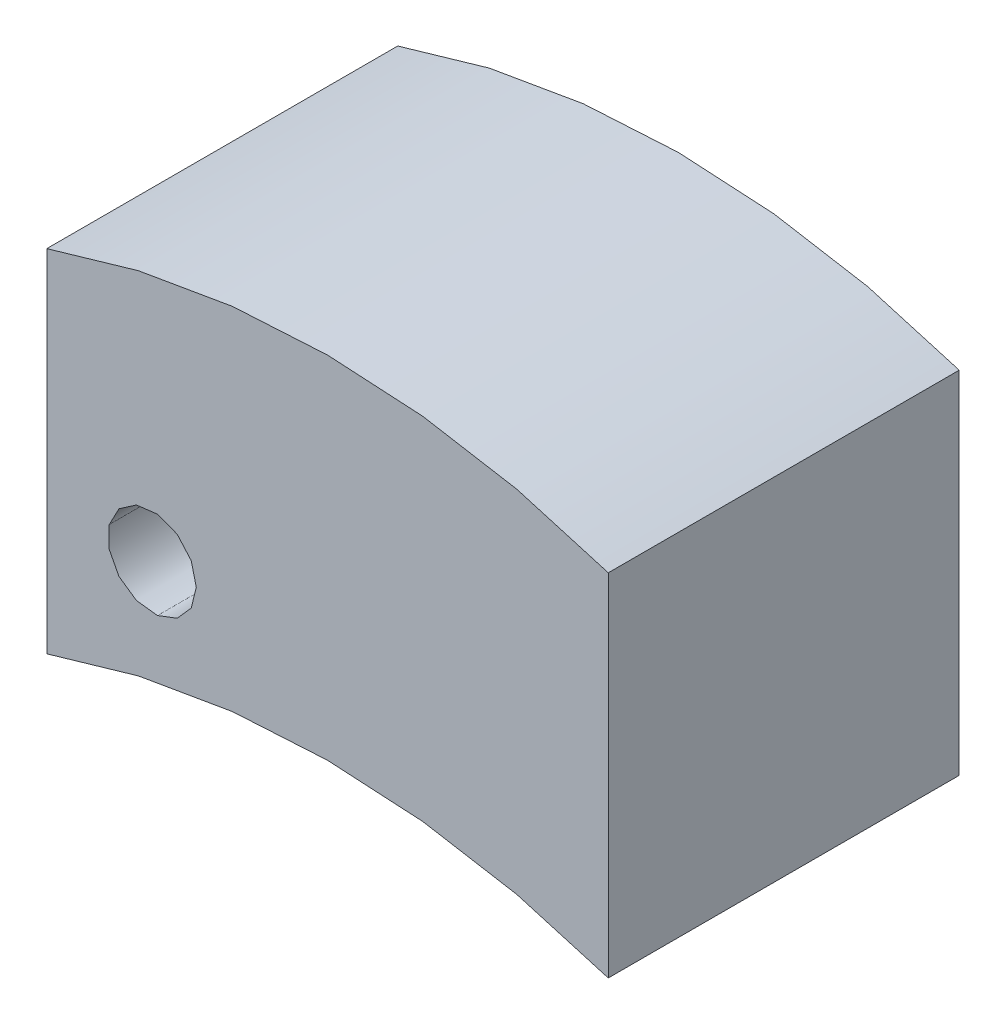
SolidWorks part; units mm, degrees
ref_plane "Front Plane" through (0, 0, 0) normal (0, 0, 1) x (1, 0, 0)
ref_plane "Top Plane" through (0, 0, 0) normal (0, 1, 0) x (1, 0, 0)
ref_plane "Right Plane" through (0, 0, 0) normal (1, 0, 0) x (0, 0, -1)
sketch "Sketch1" plane through (0, 0, 0) normal (0, 0, 1) x (1, 0, 0)
  line L2 (0, 0) -> (0, 31.75)
  line L4 (50.8, 0) -> (50.8, 31.75)
  arc A0 (50.8, 0) -> (0, 0) centre (25.4, -71.842) ccw
  arc A1 (50.8, 31.75) -> (0, 31.75) centre (25.4, -40.092) ccw
  dimension "D1" = 50.8
  dimension "D2" = 31.75
extrude "Extrude1" add sketch "Sketch1" along normal blind 31.75
sketch "Sketch4" plane through (0, 0, 31.75) normal (0, 0, 1) x (1, 0, 0)
  line L0 (0, 31.75) -> (0, 0) construction
  circle A0 centre (9.525, 11.978) radius 4
  arc A1 (50.8, 0) -> (0, 0) centre (25.4, -71.842) ccw construction
  dimension "D1" = 83.82
  dimension "D3" = 8
  dimension "D2" = 9.525
extrude "Extrude3" cut sketch "Sketch4" against normal blind 25.4
sketch "Sketch5" plane through (0, 0, 0) normal (0, 0, -1) x (-1, 0, 0)
  circle A0 centre (-25.4, 11.978) radius 2.3813
  arc A1 (0, 0) -> (-50.8, 0) centre (-25.4, -71.842) ccw construction
  point P2 (-25.4, 4.358)
  dimension "D1" = 7.62
extrude "Extrude4" cut sketch "Sketch5" against normal blind 16.51
sketch "Sketch6" plane through (0, 0, 0) normal (0, 0, -1) x (-1, 0, 0)
  circle A0 centre (-25.4, 11.978) radius 2.3813
extrude "Extrude5" add sketch "Sketch6" against normal blind 3.175
sketch "Sketch8" plane through (0, 0, 0) normal (0, 0, -1) x (-1, 0, 0)
  circle A0 centre (-25.4, 11.978) radius 0.3969
extrude "Extrude6" cut sketch "Sketch8" against normal blind 19.05
sketch "Sketch9" plane through (0, 0, 6.35) normal (0, 0, 1) x (1, 0, 0)
  circle A0 centre (9.525, 11.978) radius 0.3969
extrude "Extrude7" cut sketch "Sketch9" against normal blind 3.175
sketch "Sketch10" plane through (0, 0, 0) normal (-1, 0, 0) x (0, 0, 1)
  line L0 (3.175, 11.5811) -> (3.175, 12.3748) construction
  line L1 (6.35, 12.3748) -> (3.175, 12.3748) construction
  circle A0 centre (3.5719, 11.978) radius 0.3969
  dimension "D1" = 0.7937
  dimension "D2" = 0.3969
  dimension "D3" = 0.3969
extrude "Extrude8" cut sketch "Sketch10" against normal blind 19.05
sketch "Sketch11" plane through (0, 0, 0) normal (-1, 0, 0) x (0, 0, 1)
  circle A0 centre (3.5719, 11.978) radius 0.3969
extrude "Extrude11" add sketch "Sketch11" against normal blind 9.1281
sketch "Sketch12" plane through (50.8, 0, 0) normal (1, 0, 0) x (0, 0, -1)
  line L0 (-16.51, 12.3748) -> (-19.05, 12.3748) construction
  line L1 (-19.05, 11.5811) -> (-19.05, 12.3748) construction
  circle A0 centre (-18.6531, 11.978) radius 0.3969
extrude "Extrude12" cut sketch "Sketch12" against normal blind 32.5437
sketch "Sketch13" plane through (50.8, 0, 0) normal (1, 0, 0) x (0, 0, -1)
  circle A0 centre (-18.6531, 11.978) radius 0.3969
extrude "Extrude13" add sketch "Sketch13" against normal blind 25.0031
sketch "Sketch16" plane through (0, 0, 31.75) normal (0, 0, 1) x (1, 0, 0)
  circle A0 centre (18.6481, 11.9779) radius 0.3968
extrude "Extrude15" cut sketch "Sketch16" against normal blind 28.5751
sketch "Sketch17" plane through (0, 0, 31.75) normal (0, 0, 1) x (1, 0, 0)
  circle A0 centre (18.6481, 11.9779) radius 0.3968
extrude "Extrude17" add sketch "Sketch17" against normal blind 12.446
